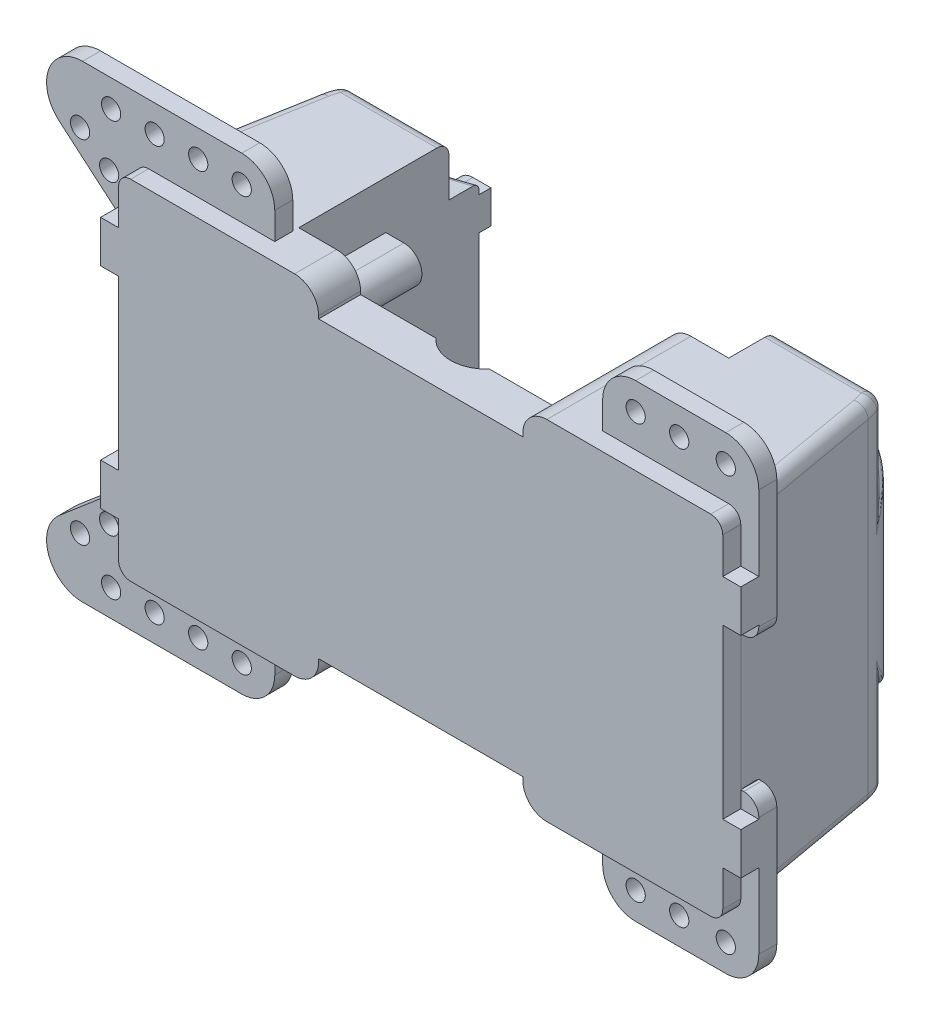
SolidWorks part; units mm, degrees
ref_plane "Face" through (0, 0, 0) normal (0, 0, 1) x (1, 0, 0)
ref_plane "Dessus" through (0, 0, 0) normal (0, 1, 0) x (1, 0, 0)
ref_plane "Droite" through (0, 0, 0) normal (1, 0, 0) x (0, 0, -1)
sketch "Esquisse1" plane through (0, 0, 0) normal (0, 0, 1) x (1, 0, 0)
  line L0 (-118.8079, 0) -> (137.6913, 0) construction
  line L1 (0, -80.2544) -> (0, 88.7519) construction
  line L2 (-53.3, -14) -> (-50.3, -14)
  line L3 (-50.3, -14) -> (-50.3, 14)
  line L4 (-17, 24.5) -> (17, 24.5)
  line L5 (-53.3, 21) -> (-50.3, 21)
  line L6 (-50.3, 21) -> (-50.3, 27)
  line L7 (-48.3, 29) -> (-21, 29)
  line L8 (-17, 24.5) -> (-17, 25)
  line L9 (-53.3, 21) -> (-53.3, 14)
  line L10 (-53.3, 14) -> (-50.3, 14)
  line L11 (-53.3, -21) -> (-53.3, -14)
  line L12 (-17, -24.5) -> (-17, -25)
  line L13 (-48.3, -29) -> (-21, -29)
  line L14 (-50.3, -21) -> (-50.3, -27)
  line L15 (-53.3, -21) -> (-50.3, -21)
  line L16 (-17, -24.5) -> (17, -24.5)
  line L17 (53.3, -21) -> (50.3, -21)
  line L18 (50.3, -21) -> (50.3, -27)
  line L19 (48.3, -29) -> (21, -29)
  line L20 (17, -24.5) -> (17, -25)
  line L21 (53.3, -21) -> (53.3, -14)
  line L22 (53.3, 14) -> (50.3, 14)
  line L23 (53.3, 21) -> (53.3, 14)
  line L24 (17, 24.5) -> (17, 25)
  line L25 (48.3, 29) -> (21, 29)
  line L26 (50.3, 21) -> (50.3, 27)
  line L27 (53.3, 21) -> (50.3, 21)
  line L28 (50.3, -14) -> (50.3, 14)
  line L29 (53.3, -14) -> (50.3, -14)
  arc A0 (-21, 29) -> (-17, 25) centre (-21, 25) cw
  arc A1 (-50.3, 27) -> (-48.3, 29) centre (-48.3, 27) cw
  arc A2 (-50.3, -27) -> (-48.3, -29) centre (-48.3, -27) ccw
  arc A3 (-21, -29) -> (-17, -25) centre (-21, -25) ccw
  arc A4 (21, -29) -> (17, -25) centre (21, -25) cw
  arc A5 (50.3, -27) -> (48.3, -29) centre (48.3, -27) cw
  arc A6 (50.3, 27) -> (48.3, 29) centre (48.3, 27) ccw
  arc A7 (21, 29) -> (17, 25) centre (21, 25) ccw
  point P13 (-17, 29)
  point P16 (-50.3, 29)
  point P32 (-50.3, 0)
  point P45 (0, -24.5)
  point P53 (0, 24.5)
  point P54 (50.3, 0)
  dimension "D5" = 4
  dimension "D6" = 2
  dimension "D1" = 100.6
  dimension "D2" = 49
  dimension "D3" = 58
  dimension "D4" = 33.3
  dimension "D7" = 7
  dimension "D8" = 28
  dimension "D9" = 3
extrude "Extrusion1" add sketch "Esquisse1" along normal blind 3
sketch "Esquisse2" plane through (0, 0, 0) normal (0, 0, -1) x (-1, 0, 0)
  line L0 (-55.4068, 0) -> (76.5637, 0) construction
  line L1 (-27.3, 29) -> (-27.3, 33.5)
  line L2 (-48.3, 29) -> (-21, 29) construction
  line L3 (-32.8, 39) -> (-47.8, 39)
  line L4 (-53.3, 33.5) -> (-53.3, 13.75)
  line L5 (-50.8, 11.25) -> (-50.3, 11.25)
  line L6 (-50.3, -14) -> (-50.3, 14) construction
  line L7 (-53.3, 14) -> (-53.3, 21) construction
  line L8 (32.8, 30.0259) -> (32.8, 50.6354) construction
  line L9 (-50.3, 11.25) -> (-27.3, 29)
  line L10 (-50.3, -11.25) -> (-27.3, -29)
  line L11 (-50.8, -11.25) -> (-50.3, -11.25)
  line L12 (-53.3, -33.5) -> (-53.3, -13.75)
  line L13 (-32.8, -39) -> (-47.8, -39)
  line L14 (-27.3, -29) -> (-27.3, -33.5)
  line L15 (0, -33) -> (0, 34.173) construction
  line L16 (32.8, -39) -> (59.3, -39)
  line L17 (53.3, -20) -> (63.1927, -28.4341)
  line L18 (53.3, 20) -> (53.3, -20)
  line L19 (53.3, 20) -> (63.1927, 28.4341)
  line L20 (53.3, -14) -> (53.3, -21) construction
  line L21 (-32.8, 30.0259) -> (-32.8, 55.68) construction
  line L22 (57.0655, 34.5) -> (-65.8833, 34.5) construction
  line L23 (-40.05, 55.68) -> (-40.05, 30.0259) construction
  line L24 (32.8, 39) -> (59.3, 39)
  line L25 (27.3, -33.5) -> (27.3, 33.5)
  line L26 (-47.8, 56.18) -> (-47.8, 29) construction
  line L27 (40.05, 30.0259) -> (40.05, 50.6354) construction
  line L28 (47.3, 30.0259) -> (47.3, 50.6354) construction
  arc A0 (-47.8, 39) -> (-53.3, 33.5) centre (-47.8, 33.5) ccw
  arc A1 (-27.3, 33.5) -> (-32.8, 39) centre (-32.8, 33.5) ccw
  arc A2 (-53.3, 13.75) -> (-50.8, 11.25) centre (-50.8, 13.75) ccw
  circle A3 centre (-47.8, 34.5) radius 1.6
  circle A4 centre (-40.05, 34.5) radius 1.6
  circle A5 centre (-32.8, 34.5) radius 1.6
  circle A6 centre (47.3, 34.5) radius 1.6
  circle A7 centre (40.05, 34.5) radius 1.6
  circle A8 centre (32.8, 34.5) radius 1.6
  arc A9 (-53.3, -13.75) -> (-50.8, -11.25) centre (-50.8, -13.75) cw
  arc A10 (-27.3, -33.5) -> (-32.8, -39) centre (-32.8, -33.5) cw
  arc A11 (-47.8, -39) -> (-53.3, -33.5) centre (-47.8, -33.5) cw
  arc A12 (63.1927, 28.4341) -> (59.3, 39) centre (59.3, 33) ccw
  arc A13 (27.3, -33.5) -> (32.8, -39) centre (32.8, -33.5) ccw
  circle A14 centre (-47.8, -34.5) radius 1.6
  circle A15 centre (-40.05, -34.5) radius 1.6
  circle A16 centre (-32.8, -34.5) radius 1.6
  arc A17 (63.1927, -28.4341) -> (59.3, -39) centre (59.3, -33) cw
  circle A18 centre (32.8, -34.5) radius 1.6
  circle A19 centre (40.05, -34.5) radius 1.6
  circle A20 centre (47.3, -34.5) radius 1.6
  arc A22 (27.3, 33.5) -> (32.8, 39) centre (32.8, 33.5) cw
  point P68 (27.3, 0)
  point P69 (53.3, 0)
  dimension "D4" = 7.25
  dimension "D5" = 2.5
  dimension "D6" = 7.25
  dimension "D7" = 12
  dimension "D8" = 6
  dimension "D1" = 78
  dimension "D2" = 26
  dimension "D3" = 22.5
  dimension "D9" = 40
  dimension "D10" = 5.5
extrude "Extrusion2" add sketch "Esquisse2" along normal blind 3
sketch "Esquisse3" plane through (0, 0, 0) normal (0, 1, 0) x (1, 0, 0)
  line L0 (0, -14.9496) -> (0, 51.3084) construction
  line L1 (50.3, 0) -> (45.762, 25.7365)
  line L3 (35.9139, 34) -> (27.3, 34)
  line L4 (27.3, 34) -> (27.3, 0)
  line L5 (17, -3) -> (-17, -3) construction
  line L6 (50.3, 0) -> (27.3, 0)
  line L8 (-50.3, 0) -> (-27.3, 0)
  line L9 (-27.3, 34) -> (-27.3, 0)
  line L10 (-35.9139, 34) -> (-27.3, 34)
  line L11 (-50.3, 0) -> (-45.762, 25.7365)
  arc A0 (45.762, 25.7365) -> (35.9139, 34) centre (35.9139, 24) ccw
  arc A1 (-45.762, 25.7365) -> (-35.9139, 34) centre (-35.9139, 24) cw
  dimension "D4" = 10
  dimension "D1" = 23
  dimension "D2" = 37
  dimension "D3" = 100
extrude "Extrusion3" add sketch "Esquisse3" along normal up to surface and the other way up to surface
sketch "Esquisse4" plane through (0, 0, -34) normal (0, 0, -1) x (-1, 0, 0)
  line L0 (0, 0) -> (-57.305, 0) construction
  line L1 (0, 0) -> (0, 41.7112) construction
  line L2 (-27.3, 20.5) -> (-37.7192, 17.9022)
  line L3 (-27.3, 29) -> (-27.3, -29) construction
  line L4 (-45.3, 8.1992) -> (-45.3, 0)
  line L5 (-45.3, 0) -> (-57.3, 0)
  line L6 (-57.3, 0) -> (-57.3, 33)
  line L7 (-57.3, 33) -> (-27.3, 33)
  line L8 (-27.3, 33) -> (-27.3, 20.5)
  line L10 (-35.9139, 29) -> (-45.762, 29) construction
  line L11 (27.3, 33) -> (27.3, 20.5)
  line L12 (57.3, 33) -> (27.3, 33)
  line L13 (57.3, 0) -> (57.3, 33)
  line L14 (45.3, 0) -> (57.3, 0)
  line L15 (45.3, 8.1992) -> (45.3, 0)
  line L16 (27.3, 20.5) -> (37.7192, 17.9022)
  arc A0 (-37.7192, 17.9022) -> (-45.3, 8.1992) centre (-35.3, 8.1992) ccw
  arc A1 (37.7192, 17.9022) -> (45.3, 8.1992) centre (35.3, 8.1992) cw
  dimension "D5" = 10
  dimension "D1" = 30
  dimension "D2" = 8
  dimension "D3" = 41
  dimension "D4" = 76
  dimension "D6" = 4
extrude "Enlèv. mat.-Extru.1" cut sketch "Esquisse4" against normal blind 5
mirror "Symétrie1" about plane through (0, 0, 0) normal (0, 1, 0) of "Enlèv. mat.-Extru.1"
sketch "Esquisse5" plane through (0, 0, 0) normal (0, 0, -1) x (-1, 0, 0)
  line L1 (-27.3, 29) -> (-27.3, -29) construction
  line L4 (-27.3, 29) -> (-21, 29) construction
  line L6 (-27.3, 29) -> (-27.3, 22.5)
  line L7 (-27.3, -22.5) -> (-17, -22.5)
  line L8 (-17, -25) -> (-17, -22.5)
  line L9 (-27.3, 29) -> (-21, 29)
  line L10 (-17, 25) -> (-17, 24.5) construction
  line L11 (-17, 25) -> (-17, 22.5)
  line L13 (-27.3, -29) -> (-21, -29)
  line L14 (-27.3, -29) -> (-27.3, -22.5)
  line L16 (-8.8427, 0) -> (-36.7614, 0) construction
  line L17 (-17, 22.5) -> (17, 22.5)
  line L18 (-27.3, 22.5) -> (-17, 22.5)
  arc A1 (-17, 25) -> (-21, 29) centre (-21, 25) ccw construction
  arc A2 (-17, -25) -> (-21, -29) centre (-21, -25) cw
  arc A3 (-17, 25) -> (-21, 29) centre (-21, 25) ccw
  dimension "D1" = 2
extrude "Extrusion4" add sketch "Esquisse5" along normal blind 21
sketch "Esquisse6" plane through (0, 0, -3) normal (0, 0, -1) x (-1, 0, 0)
  line L0 (31.2, 34.5) -> (59.0743, 34.5) construction
  line L1 (0, 0) -> (59.3, 0) construction
  line L2 (54.55, 24) -> (54.55, 34.5) construction
  line L3 (54.55, 29.25) -> (62.0962, 29.25) construction
  circle A0 centre (32.8, 34.5) radius 1.6 construction
  circle A1 centre (54.8763, 25.5) radius 1.6
  circle A2 centre (47.3, 34.5) radius 1.6 construction
  circle A3 centre (54.8763, -25.5) radius 1.6
  circle A4 centre (54.55, -34.5) radius 1.6
  circle A5 centre (59.7237, 29.25) radius 1.6
  circle A6 centre (59.7237, -29.25) radius 1.6
  circle A8 centre (54.55, 34.5) radius 1.6
  dimension "D1" = 7.25
  dimension "D5" = 51
extrude "Enlèv. mat.-Extru.2" cut sketch "Esquisse6" against normal through all
sketch "Esquisse7" plane through (0, 0, 0) normal (0, 0, -1) x (-1, 0, 0)
  line L3 (21, 29) -> (27.3, 29) construction
  line L4 (-17, 24.5) -> (17, 24.5) construction
  line L5 (21, 29) -> (27.3, 29)
  line L6 (21, 27) -> (27.3, 27)
  line L7 (19, 22.5) -> (19, 25)
  line L8 (-17, 22.5) -> (19, 22.5)
  line L9 (21, 27) -> (27.3, 27)
  line L10 (19, 22.5) -> (19, 25)
  line L11 (-17, 22.5) -> (19, 22.5)
  line L12 (-17, 24.5) -> (17, 24.5)
  line L13 (27.3, 29) -> (27.3, 27)
  line L14 (-17, 24.5) -> (-17, 22.5)
  line L15 (-9.3931, 0) -> (13.5731, 0) construction
  line L16 (-17, -24.5) -> (-17, -22.5)
  line L17 (27.3, -29) -> (27.3, -27)
  line L18 (-17, -24.5) -> (17, -24.5)
  line L19 (-17, -22.5) -> (19, -22.5)
  line L20 (19, -22.5) -> (19, -25)
  line L21 (21, -27) -> (27.3, -27)
  line L22 (21, -29) -> (27.3, -29)
  line L23 (17, 24.5) -> (17, 25) construction
  line L24 (17, 24.5) -> (17, 25)
  line L25 (17, -25) -> (17, -24.5) construction
  line L26 (17, -25) -> (17, -24.5)
  arc A1 (21, 29) -> (17, 25) centre (21, 25) ccw construction
  arc A2 (21, 27) -> (19, 25) centre (21, 25) ccw
  arc A3 (21, 27) -> (19, 25) centre (21, 25) ccw
  arc A4 (21, 29) -> (17, 25) centre (21, 25) ccw
  arc A5 (21, -29) -> (17, -25) centre (21, -25) cw
  arc A6 (21, -27) -> (19, -25) centre (21, -25) cw
  dimension "D1" = 2
extrude "Extrusion5" add sketch "Esquisse7" along normal blind 4
sketch "Esquisse8" plane through (0, 0, 0) normal (0, 0, -1) x (-1, 0, 0)
  line L0 (24.3, -15.05) -> (27.3, -15.05)
  line L1 (27.3, 20.5) -> (27.3, -20.5) construction
  line L2 (24.3, -21.05) -> (27.3, -21.05)
  line L3 (-11.5335, 0) -> (18.5503, 0) construction
  line L4 (0, 10.7046) -> (0, -7.7516) construction
  line L5 (27.3, -15.05) -> (27.3, -21.05)
  line L6 (27.3, 15.05) -> (27.3, 21.05)
  line L7 (24.3, 21.05) -> (27.3, 21.05)
  line L8 (24.3, 15.05) -> (27.3, 15.05)
  line L9 (-24.3, 15.05) -> (-27.3, 15.05)
  line L10 (-24.3, 21.05) -> (-27.3, 21.05)
  line L11 (-27.3, 15.05) -> (-27.3, 21.05)
  line L12 (-27.3, -15.05) -> (-27.3, -21.05)
  line L13 (-24.3, -21.05) -> (-27.3, -21.05)
  line L14 (-24.3, -15.05) -> (-27.3, -15.05)
  arc A0 (24.3, -15.05) -> (24.3, -21.05) centre (24.3, -18.05) ccw
  circle A1 centre (24.3, -18.05) radius 1
  circle A2 centre (24.3, 18.05) radius 1
  arc A3 (24.3, 15.05) -> (24.3, 21.05) centre (24.3, 18.05) cw
  arc A4 (-24.3, 15.05) -> (-24.3, 21.05) centre (-24.3, 18.05) ccw
  circle A5 centre (-24.3, 18.05) radius 1
  circle A6 centre (-24.3, -18.05) radius 1
  arc A7 (-24.3, -15.05) -> (-24.3, -21.05) centre (-24.3, -18.05) cw
  dimension "D1" = 3
  dimension "D4" = 2
  dimension "D2" = 36.1
  dimension "D3" = 48.6
extrude "Extrusion6" add sketch "Esquisse8" along normal blind 18.5
sketch "Esquisse9" plane through (0, 0, 0) normal (0, 1, 0) x (1, 0, 0)
  line L0 (21, 21) -> (27.3, 21) construction
  circle A0 centre (0, 8) radius 6
  dimension "D1" = 12
  dimension "D2" = 13
extrude "Enlèv. mat.-Extru.3" cut sketch "Esquisse9" against normal through all and the other way through all
sketch "Esquisse10" plane through (0, 0, -34) normal (0, 0, -1) x (-1, 0, 0)
  line L0 (0, 0) -> (-16.8858, 0) construction
  line L1 (0, 0) -> (0, -13.4731) construction
  line L2 (-27.3, 20.5) -> (-27.3, -20.5) construction
  line L3 (-27.3, -13.25) -> (-27.3, -18.75)
  line L4 (-30.3, -18.75) -> (-27.3, -18.75)
  line L5 (-30.3, -13.25) -> (-27.3, -13.25)
  line L6 (-30.3, 13.25) -> (-27.3, 13.25)
  line L7 (-30.3, 18.75) -> (-27.3, 18.75)
  line L8 (-27.3, 13.25) -> (-27.3, 18.75)
  line L9 (27.3, 13.25) -> (27.3, 18.75)
  line L10 (30.3, 18.75) -> (27.3, 18.75)
  line L11 (30.3, 13.25) -> (27.3, 13.25)
  line L12 (30.3, -13.25) -> (27.3, -13.25)
  line L13 (30.3, -18.75) -> (27.3, -18.75)
  line L14 (27.3, -13.25) -> (27.3, -18.75)
  circle A0 centre (-30.3, -16) radius 1
  arc A1 (-30.3, -13.25) -> (-30.3, -18.75) centre (-30.3, -16) ccw
  arc A2 (-30.3, 13.25) -> (-30.3, 18.75) centre (-30.3, 16) cw
  circle A3 centre (-30.3, 16) radius 1
  circle A4 centre (30.3, 16) radius 1
  arc A5 (30.3, 13.25) -> (30.3, 18.75) centre (30.3, 16) ccw
  arc A6 (30.3, -13.25) -> (30.3, -18.75) centre (30.3, -16) cw
  circle A7 centre (30.3, -16) radius 1
  dimension "D1" = 2.75
  dimension "D4" = 2
  dimension "D2" = 60.6
  dimension "D3" = 32
extrude "Extrusion7" add sketch "Esquisse10" along normal blind 2
fillet "Congé1" radius 2 16 edges at (45.3108, -29, -27.4202) (45.3108, 29, -27.4202) (-45.3108, -29, -27.4202) (-45.3108, 29, -27.4202) (-35.9371, -29, -29) (47.7665, -29, -14.3682) (35.9371, -29, -29) (44.5741, -20.4698, -29) (-35.9371, 29, -29) (35.9371, 29, -29) (44.5741, 20.4698, -29) (47.7665, 29, -14.3682) (-47.7665, -29, -14.3682) (-44.5741, -20.4698, -29) (-44.5741, 20.4698, -29) (-47.7665, 29, -14.3682)
fillet "Congé2" radius 1 12 edges at (43.2703, 14.2387, -30.7738) (36.8203, 18.1263, -33.9588) (43.2703, -14.2387, -30.7738) (36.8203, -18.1263, -33.9588) (-31.6069, 19.4262, -34) (-36.8203, 18.1263, -33.9588) (-31.6069, -19.4262, -34) (-36.8203, -18.1263, -33.9588) (31.6069, 19.4262, -34) (31.6069, -19.4262, -34) (-42.1851, 15.4515, -31.7892) (-43.3753, -14.0976, -30.6579)
